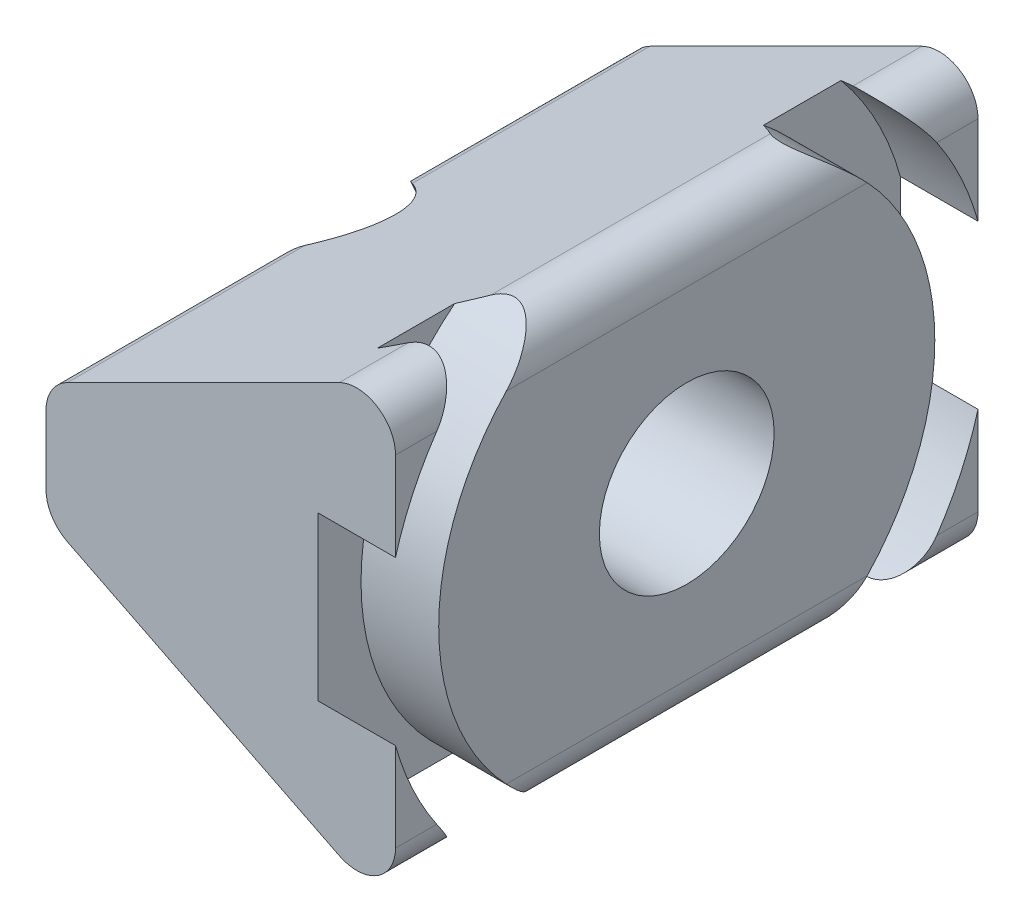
SolidWorks part; units mm, degrees
ref_plane "Plan de face" through (0, 0, 0) normal (0, 0, 1) x (1, 0, 0)
ref_plane "Plan de dessus" through (0, 0, 0) normal (0, 1, 0) x (1, 0, 0)
ref_plane "Plan de droite" through (0, 0, 0) normal (1, 0, 0) x (0, 0, -1)
sketch "Esquisse1" plane through (0, 0, 0) normal (0, 0, 1) x (1, 0, 0)
  line L0 (-9, 0) -> (-9, 1.5)
  line L1 (-9, 1.5) -> (0, 6)
  line L2 (0, 6) -> (0, 0)
  line L3 (0, 0) -> (-9, 0)
  dimension "D1" = 9
  dimension "D2" = 1.5
  dimension "D3" = 6
extrude "Extrusion1" add sketch "Esquisse1" along normal blind 15
mirror "Symétrie1" about plane through (0, 0, 15) normal (0, 1, 0) of "Extrusion1"
fillet "Congé2" radius 1 4 edges at (-9, -1.5, 7.5) (0, -6, 7.5) (-9, 1.5, 7.5) (0, 6, 7.5)
sketch "Esquisse3" plane through (0, 0, 0) normal (1, 0, 0) x (0, 0, -1)
  line L3 (0, -4.382) -> (0, 4.382) construction
  circle A0 centre (-7.5, 0) radius 7.7875
  circle A1 centre (-7.5, 0) radius 6.3875
  dimension "D1" = 1.4
  dimension "D2" = 7.5
extrude "Enlèv. mat.-Extru.2" cut sketch "Esquisse3" against normal blind 2
sketch "Esquisse4" plane through (0, 0, 0) normal (1, 0, 0) x (0, 0, -1)
  circle A0 centre (-7.5, 0) radius 2.25
  dimension "D1" = 4.5
extrude "Enlèv. mat.-Extru.3" cut sketch "Esquisse4" against normal through all
